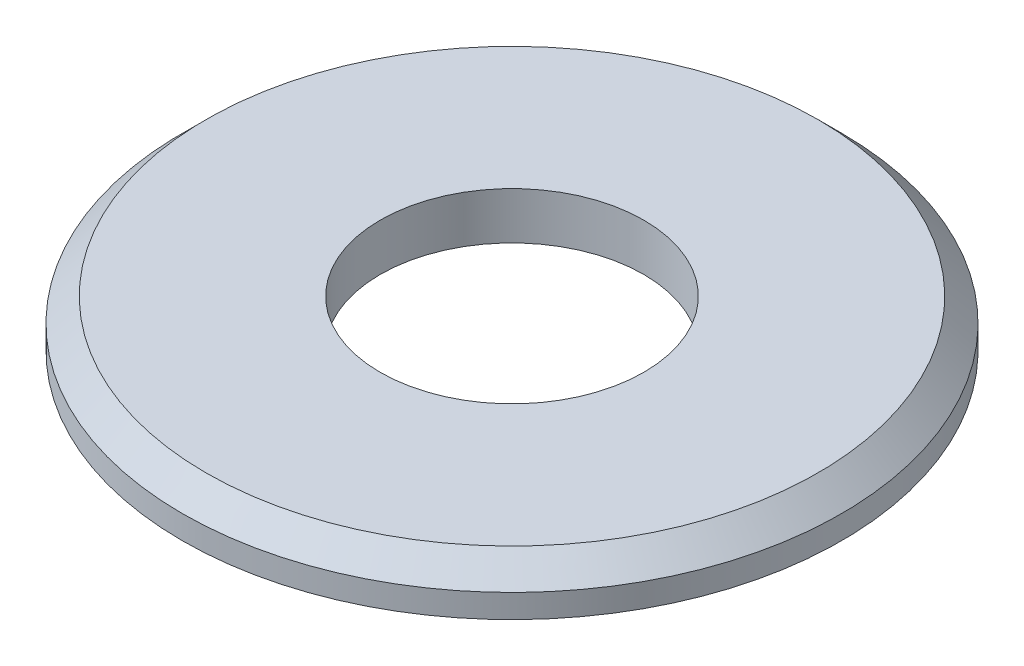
SolidWorks part; units mm, degrees
ref_plane "Front" through (0, 0, 0) normal (0, 0, 1) x (1, 0, 0)
ref_plane "Top" through (0, 0, 0) normal (0, 1, 0) x (1, 0, 0)
ref_plane "Right" through (0, 0, 0) normal (1, 0, 0) x (0, 0, -1)
sketch "Sketch1" plane through (0, 0, 0) normal (0, 1, 0) x (1, 0, 0)
  circle A0 centre (0, 0) radius 1.4
  circle A1 centre (0, 0) radius 3.5
extrude "Extrude1" add sketch "Sketch1" along normal blind 0.5
chamfer "Chamfer1" distance 0.25 1 edges at (0, 0.5, 3.5)
